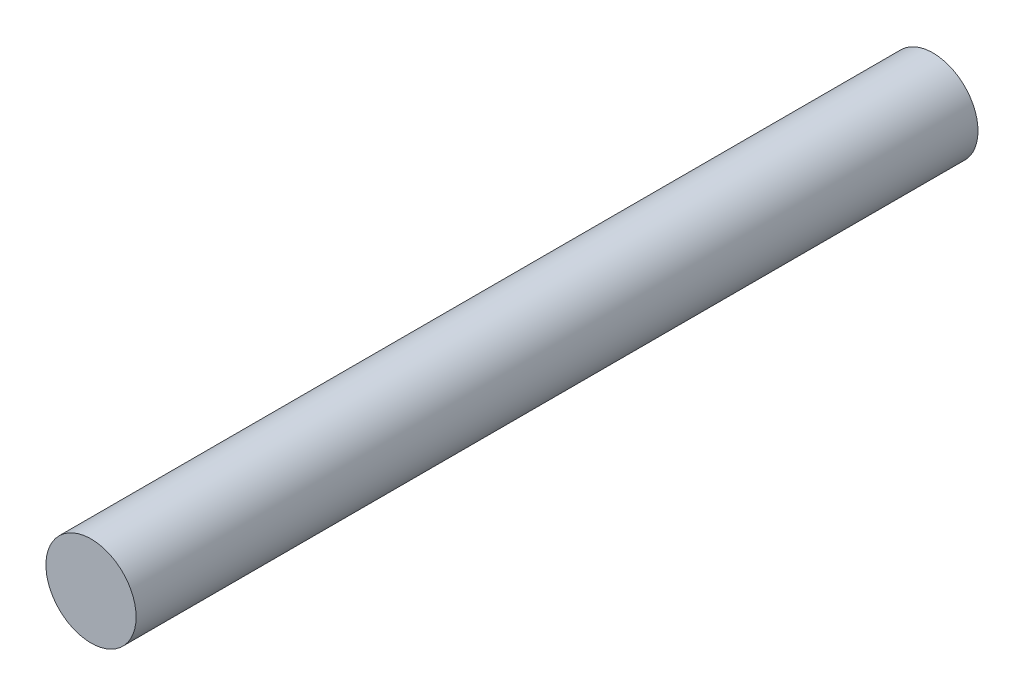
SolidWorks part; units mm, degrees
ref_plane "Front Plane" through (0, 0, 0) normal (0, 0, 1) x (1, 0, 0)
ref_plane "Top Plane" through (0, 0, 0) normal (0, 1, 0) x (1, 0, 0)
ref_plane "Right Plane" through (0, 0, 0) normal (1, 0, 0) x (0, 0, -1)
sketch "Sketch1" plane through (0, 0, 0) normal (0, 0, 1) x (1, 0, 0)
  circle A0 centre (0, 0) radius 4.7625
  dimension "D1" = 9.525
extrude "Extrude1" add sketch "Sketch1" along normal blind 88.9
